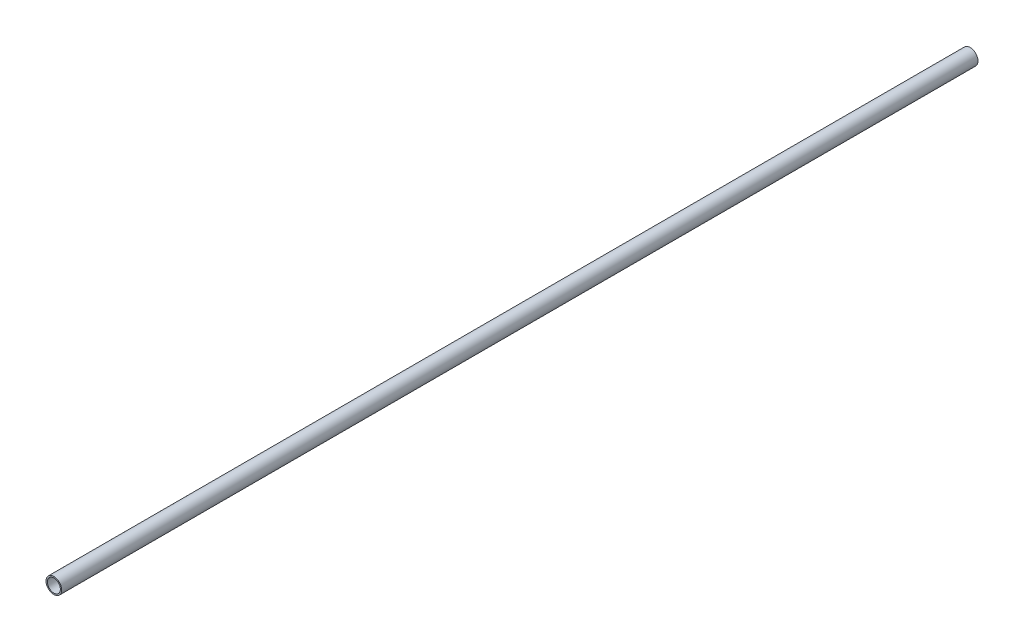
SolidWorks part; units mm, degrees
ref_plane "Front Plane" through (0, 0, 0) normal (0, 0, 1) x (1, 0, 0)
ref_plane "Top Plane" through (0, 0, 0) normal (0, 1, 0) x (1, 0, 0)
ref_plane "Right Plane" through (0, 0, 0) normal (1, 0, 0) x (0, 0, -1)
sketch "Sketch1" plane through (0, 0, 0) normal (0, 0, 1) x (1, 0, 0)
  circle A0 centre (0, 0) radius 15
  circle A1 centre (0, 0) radius 18
extrude "Extrude1" add sketch "Sketch1" along normal blind 2100
